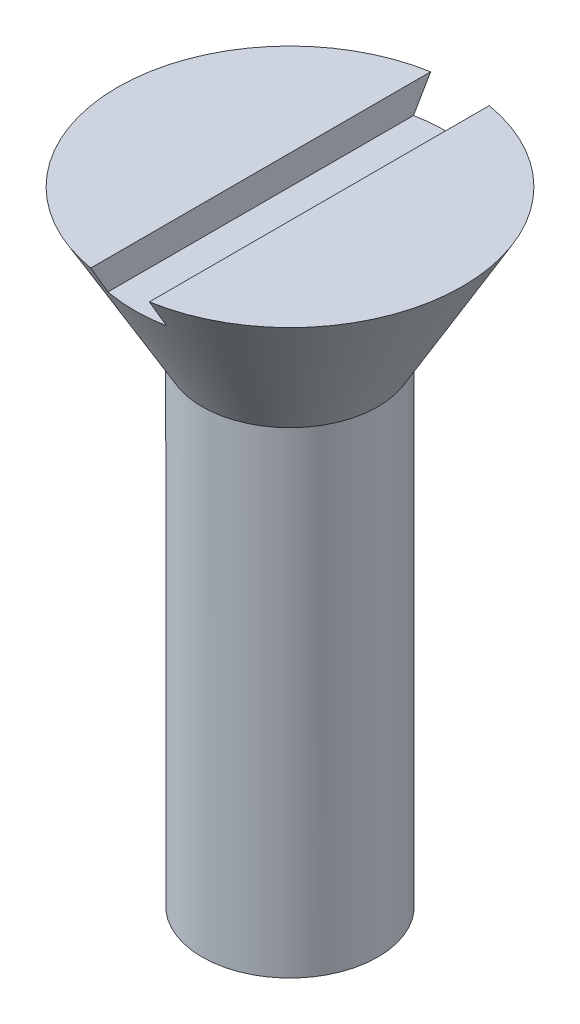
SolidWorks part; units mm, degrees
ref_plane "Front Plane" through (0, 0, 0) normal (0, 0, 1) x (1, 0, 0)
ref_plane "Top Plane" through (0, 0, 0) normal (0, 1, 0) x (1, 0, 0)
ref_plane "Right Plane" through (0, 0, 0) normal (1, 0, 0) x (0, 0, -1)
sketch "Sketch1" plane through (0, 0, 0) normal (0, 0, 1) x (1, 0, 0)
  line L0 (0, 0) -> (0, 29.3491) construction
  line L1 (0, 0) -> (0, 23)
  line L2 (0, 23) -> (-5.8868, 23)
  line L3 (-5.8868, 23) -> (-3, 18)
  line L4 (-3, 18) -> (-3, 1.7321)
  line L5 (-3, 1.7321) -> (0, 0)
  dimension "D1" = 60
  dimension "D2" = 6
  dimension "D3" = 18
  dimension "D4" = 30
  dimension "D5" = 5
revolve "Revolve1" add sketch "Sketch1" angle 360 about L0
sketch "Sketch2" plane through (0, 23, 0) normal (0, 1, 0) x (1, 0, 0)
  line L1 (-1, 6.9957) -> (1, 6.9957)
  line L2 (-1, 6.9957) -> (-1, -6.9957)
  line L3 (-1, -6.9957) -> (1, -6.9957)
  line L4 (1, 6.9957) -> (1, -6.9957)
  point P4 (0, 6.9957)
  point P6 (-1, 0)
  dimension "D1" = 2
extrude "Extrude1" cut sketch "Sketch2" against normal blind 1
